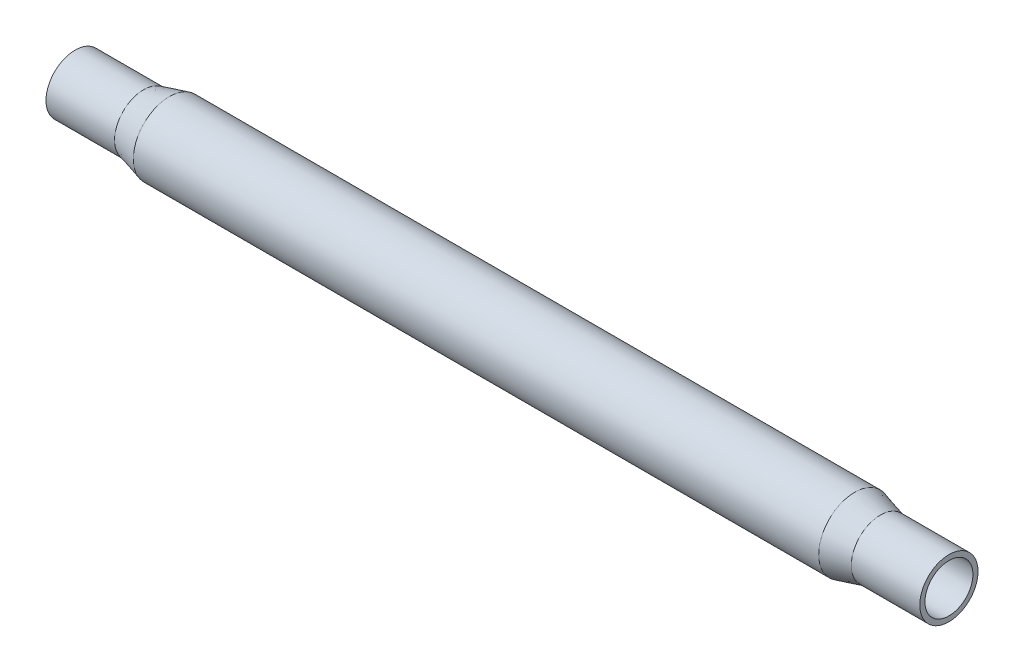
SolidWorks part; units mm, degrees
ref_plane "Plan de face" through (0, 0, 0) normal (0, 0, 1) x (1, 0, 0)
ref_plane "Plan de dessus" through (0, 0, 0) normal (0, 1, 0) x (1, 0, 0)
ref_plane "Plan de droite" through (0, 0, 0) normal (1, 0, 0) x (0, 0, -1)
sketch "Esquisse1" plane through (0, 0, 0) normal (0, 0, 1) x (1, 0, 0)
  line L0 (-91.8957, 0) -> (124.2758, 0) construction
  line L1 (-67.0085, 17) -> (-27.0085, 17)
  line L2 (-27.0085, 17) -> (-12.0085, 21)
  line L3 (-12.0085, 21) -> (387.9915, 21)
  line L4 (387.9915, 21) -> (402.9915, 17)
  line L5 (402.9915, 17) -> (442.9915, 17)
  dimension "D1" = 40
  dimension "D2" = 400
  dimension "D3" = 40
  dimension "D4" = 15
  dimension "D5" = 15
  dimension "D6" = 34
  dimension "D7" = 42
  dimension "D8" = 34
revolve "Révol.-Mince1" add sketch "Esquisse1" angle 360 about L0
